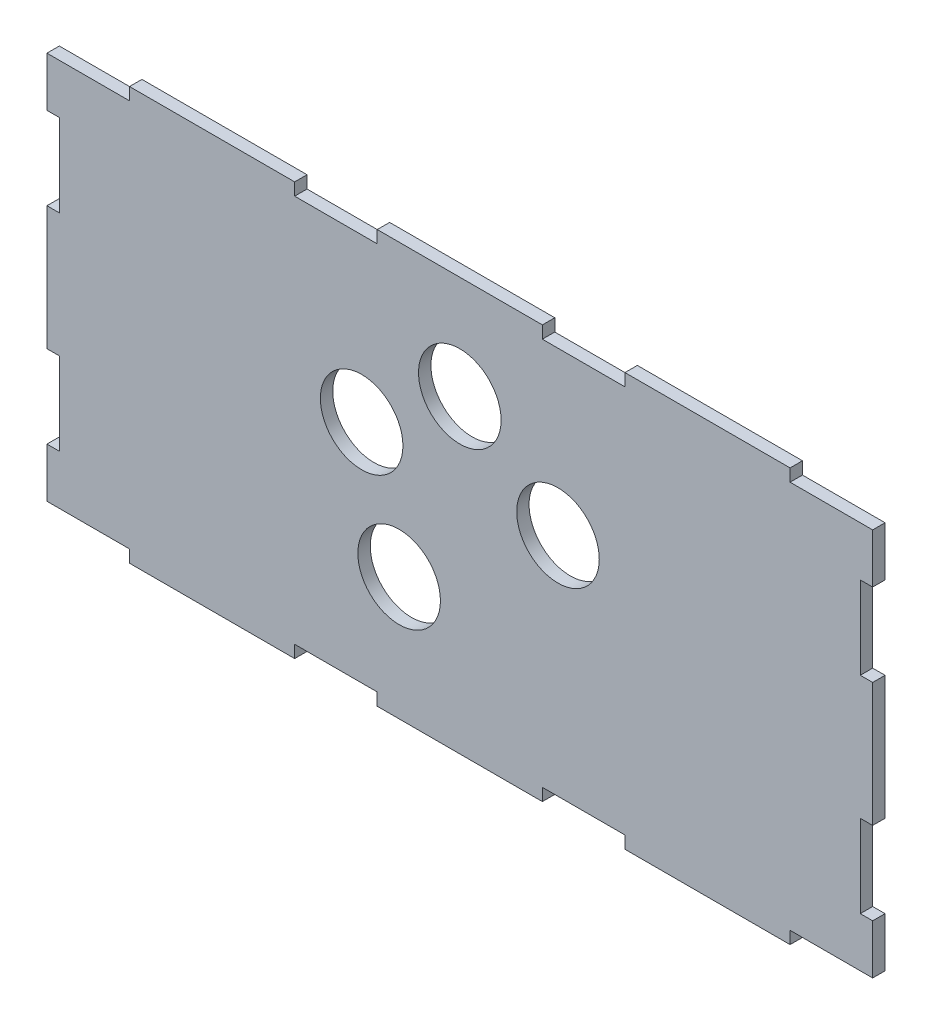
SolidWorks part; units mm, degrees
ref_plane "前视基准面" through (0, 0, 0) normal (0, 0, 1) x (1, 0, 0)
ref_plane "上视基准面" through (0, 0, 0) normal (0, 1, 0) x (1, 0, 0)
ref_plane "右视基准面" through (0, 0, 0) normal (1, 0, 0) x (0, 0, -1)
sketch "草图1" plane through (0, 0, 0) normal (0, 0, 1) x (1, 0, 0)
  line L0 (-100, 50) -> (100, 50)
  line L2 (100, -50) -> (-100, -50)
  line L3 (-100, -50) -> (-100, 50)
  line L4 (0, 0) -> (0, 25) construction
  line L5 (100, 50) -> (100, -50)
  circle A1 centre (0, 25) radius 10
  circle A2 centre (23.7764, 7.7254) radius 10
  circle A4 centre (-14.6946, -20.2254) radius 10
  circle A5 centre (-23.7764, 7.7254) radius 10
  circle A6 centre (14.6946, -20.2254) radius 10
  point P4 (0, 50)
  point P6 (-100, 0)
  dimension "D4" = 20
  dimension "D1" = 100
  dimension "D2" = 200
  dimension "D6" = 25
  dimension "D5" = 5
extrude "凸台-拉伸1" add sketch "草图1" along normal blind 3
sketch "草图2" plane through (0, 0, 3) normal (0, 0, 1) x (1, 0, 0)
  line L0 (-40, -50) -> (-40, -47)
  line L1 (-100, -50) -> (100, -50) construction
  line L2 (-40, -47) -> (-20, -47)
  line L3 (-20, -47) -> (-20, -50)
  line L4 (-20, -50) -> (-40, -50)
  line L9 (20, -50) -> (20, -47)
  line L10 (20, -47) -> (40, -47)
  line L11 (40, -47) -> (40, -50)
  line L12 (40, -50) -> (20, -50)
  line L18 (-100, -47) -> (-80, -47)
  line L19 (-100, 50) -> (-100, -50) construction
  line L20 (-80, -47) -> (-80, -50)
  line L21 (-80, -50) -> (-100, -50)
  line L22 (-100, -50) -> (-100, -47)
  line L23 (100, -50) -> (100, 50) construction
  line L45 (-100, 35) -> (-97, 35)
  line L46 (-97, 35) -> (-97, 15)
  line L47 (-97, 15) -> (-100, 15)
  line L48 (-100, 15) -> (-100, 35)
  line L49 (-100, -15) -> (-97, -15)
  line L50 (-97, -15) -> (-97, -35)
  line L51 (-97, -35) -> (-100, -35)
  line L52 (-100, -35) -> (-100, -15)
  line L53 (0, 50) -> (0, -50) construction
  line L54 (97, -35) -> (100, -35)
  line L55 (97, -15) -> (97, -35)
  line L56 (100, -15) -> (97, -15)
  line L57 (100, -35) -> (100, -15)
  line L58 (97, 15) -> (100, 15)
  line L59 (97, 35) -> (97, 15)
  line L60 (100, 35) -> (97, 35)
  line L61 (100, 15) -> (100, 35)
  line L62 (80, -50) -> (80, -47)
  line L63 (100, -47) -> (100, -50)
  line L64 (100, -50) -> (80, -50)
  line L65 (80, -47) -> (100, -47)
  line L66 (80, 47) -> (100, 47)
  line L67 (100, 50) -> (80, 50)
  line L68 (100, 47) -> (100, 50)
  line L69 (80, 50) -> (80, 47)
  line L70 (-100, 50) -> (-100, 47)
  line L71 (-80, 50) -> (-100, 50)
  line L72 (-80, 47) -> (-80, 50)
  line L73 (-100, 47) -> (-80, 47)
  line L74 (40, 50) -> (20, 50)
  line L75 (40, 47) -> (40, 50)
  line L76 (20, 47) -> (40, 47)
  line L77 (20, 50) -> (20, 47)
  line L78 (-20, 50) -> (-40, 50)
  line L79 (-20, 47) -> (-20, 50)
  line L80 (-40, 47) -> (-20, 47)
  line L81 (-40, 50) -> (-40, 47)
  line L82 (-100, -50) -> (100, -50) construction
  line L83 (100, -50) -> (100, 50) construction
  point P61 (-98.5, -15)
  dimension "D1" = 20
  dimension "D2" = 3
  dimension "D3" = 40
  dimension "D4" = 20
  dimension "D5" = 40
  dimension "D6" = 40
  dimension "D7" = 3
  dimension "D8" = 20
  dimension "D9" = 3
  dimension "D10" = 12
  dimension "D12" = 20
  dimension "D13" = 30
  dimension "D14" = 20
  dimension "D15" = 3
  dimension "D16" = 3
extrude "切除-拉伸1" cut sketch "草图2" against normal blind 10
